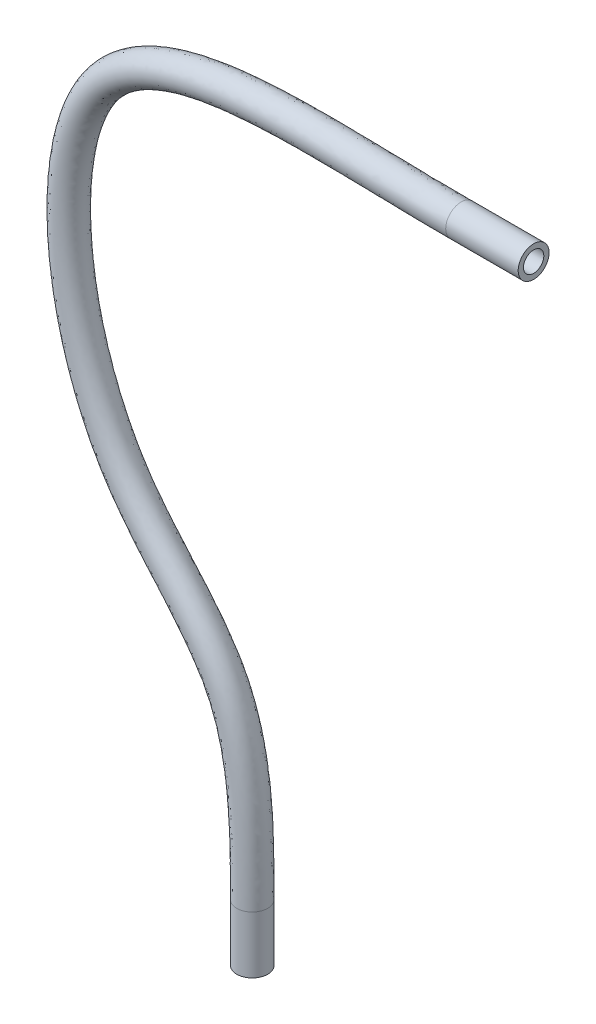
SolidWorks part; units mm, degrees
ref_plane "Plan de face" through (0, 0, 0) normal (0, 0, 1) x (1, 0, 0)
ref_plane "Plan de dessus" through (0, 0, 0) normal (0, 1, 0) x (1, 0, 0)
ref_plane "Plan de droite" through (0, 0, 0) normal (1, 0, 0) x (0, 0, -1)
sketch "Esquisse1" plane through (0, 0, 0) normal (0, 1, 0) x (1, 0, 0)
  circle A0 centre (0, 0) radius 2.5
  circle A1 centre (0, 0) radius 1.6437
  dimension "D1" = 5
sketch "Esquisse2" plane through (0, 0, 0) normal (0, 0, 1) x (1, 0, 0)
  line L0 (0, 0) -> (0, 9.2399)
  line L1 (33.7907, 121.3163) -> (45.5086, 121.3163)
  spline S0 degree 3 poles (0, 9.2399) (0, 19.2166) (-0.1997, 38.875) (-29.4074, 61.9) (-35.7251, 127.2) (9.6468, 121.3163) (33.7907, 121.3163) knots 0 0 0 0 0.169074 0.333157 0.646796 1 1 1 1
sweep "Balayage1" add profiles "Esquisse1" path "Esquisse2"
